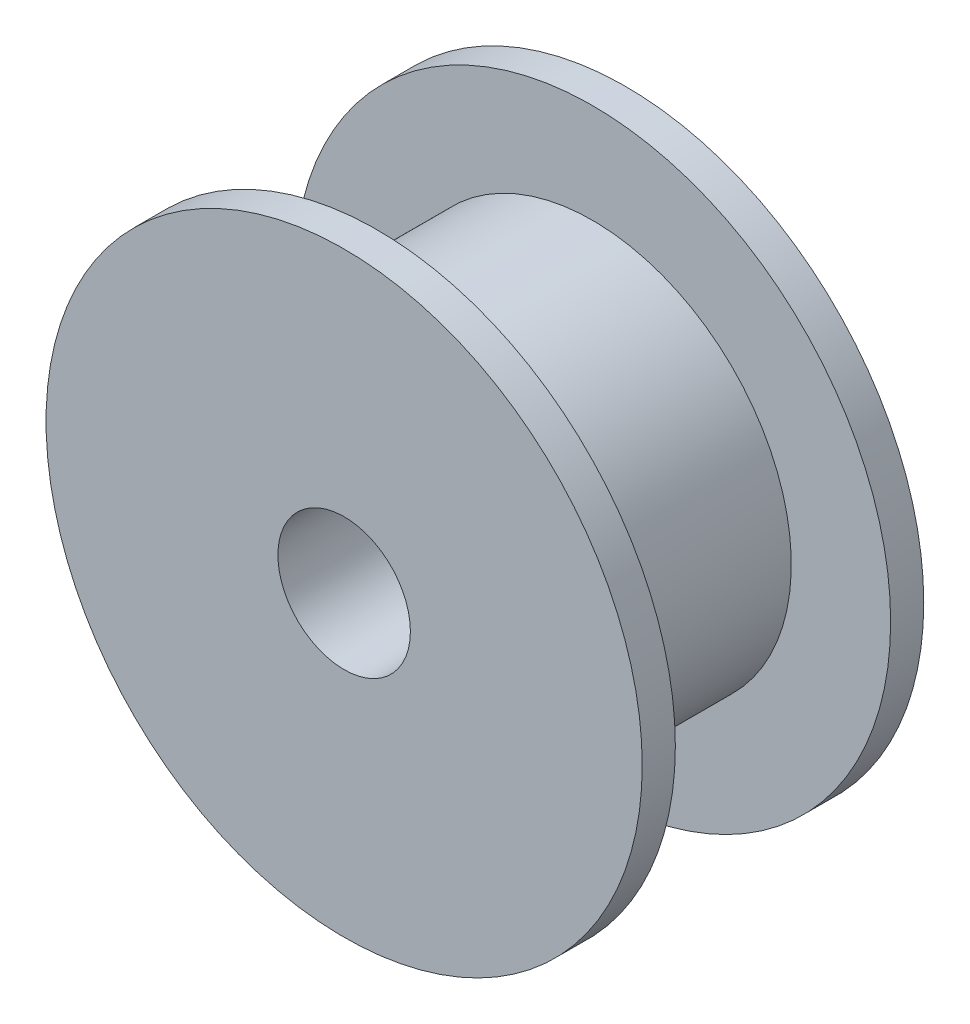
SolidWorks part; units mm, degrees
ref_plane "Alzado" through (0, 0, 0) normal (0, 0, 1) x (1, 0, 0)
ref_plane "Planta" through (0, 0, 0) normal (0, 1, 0) x (1, 0, 0)
ref_plane "Vista lateral" through (0, 0, 0) normal (1, 0, 0) x (0, 0, -1)
sketch "Croquis1" plane through (0, 0, 0) normal (0, 0, 1) x (1, 0, 0)
  circle A0 centre (0, 0) radius 9
  circle A1 centre (0, 0) radius 2
  dimension "D1" = 4
  dimension "D2" = 18
extrude "Saliente-Extruir1" add sketch "Croquis1" along normal blind 1
sketch "Croquis2" plane through (0, 0, 1) normal (0, 0, 1) x (1, 0, 0)
  circle A0 centre (0, 0) radius 2 construction
  circle A1 centre (0, 0) radius 2
  circle A2 centre (0, 0) radius 6
  dimension "D1" = 12
extrude "Saliente-Extruir2" add sketch "Croquis2" along normal blind 6.5
sketch "Croquis3" plane through (0, 0, 7.5) normal (0, 0, 1) x (1, 0, 0)
  circle A0 centre (0, 0) radius 9 construction
  circle A1 centre (0, 0) radius 9
  circle A2 centre (0, 0) radius 2 construction
  circle A3 centre (0, 0) radius 2
extrude "Saliente-Extruir3" add sketch "Croquis3" along normal blind 1
